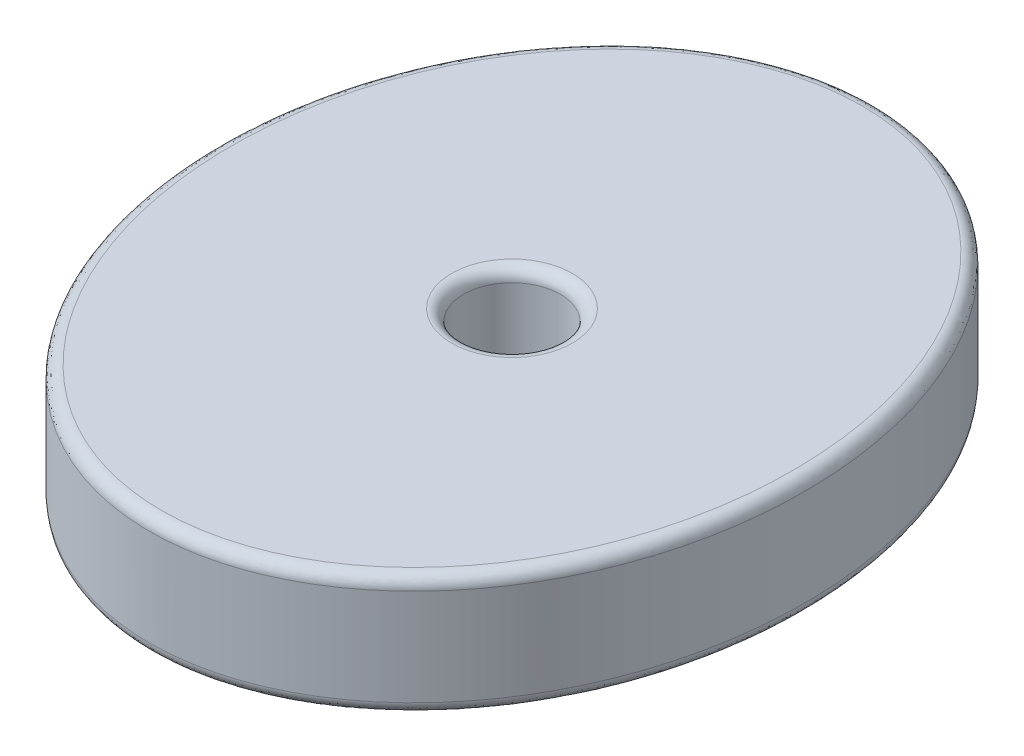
SolidWorks part; units mm, degrees
ref_plane "Front Plane" through (0, 0, 0) normal (0, 0, 1) x (1, 0, 0)
ref_plane "Top Plane" through (0, 0, 0) normal (0, 1, 0) x (1, 0, 0)
ref_plane "Right Plane" through (0, 0, 0) normal (1, 0, 0) x (0, 0, -1)
sketch "Sketch2" plane through (0, 0, 0) normal (0, 1, 0) x (1, 0, 0)
  line L0 (0, -55) -> (0, 55) construction
  circle A0 centre (0, 0) radius 4
  ellipse E0 centre (0, 0) end of major axis (0, 30) minor radius 24.2535
extrude "Boss-Extrude1" add sketch "Sketch2" along normal blind 10
sketch "Sketch3" plane through (0, 10, 0) normal (0, 1, 0) x (1, 0, 0)
  circle A0 centre (0, 15) radius 1
  dimension "D1" = 15
fillet "Fillet1" radius 1 3 edges at (0, 10, 4) (0, 10, -30) (0, 0, -30)
